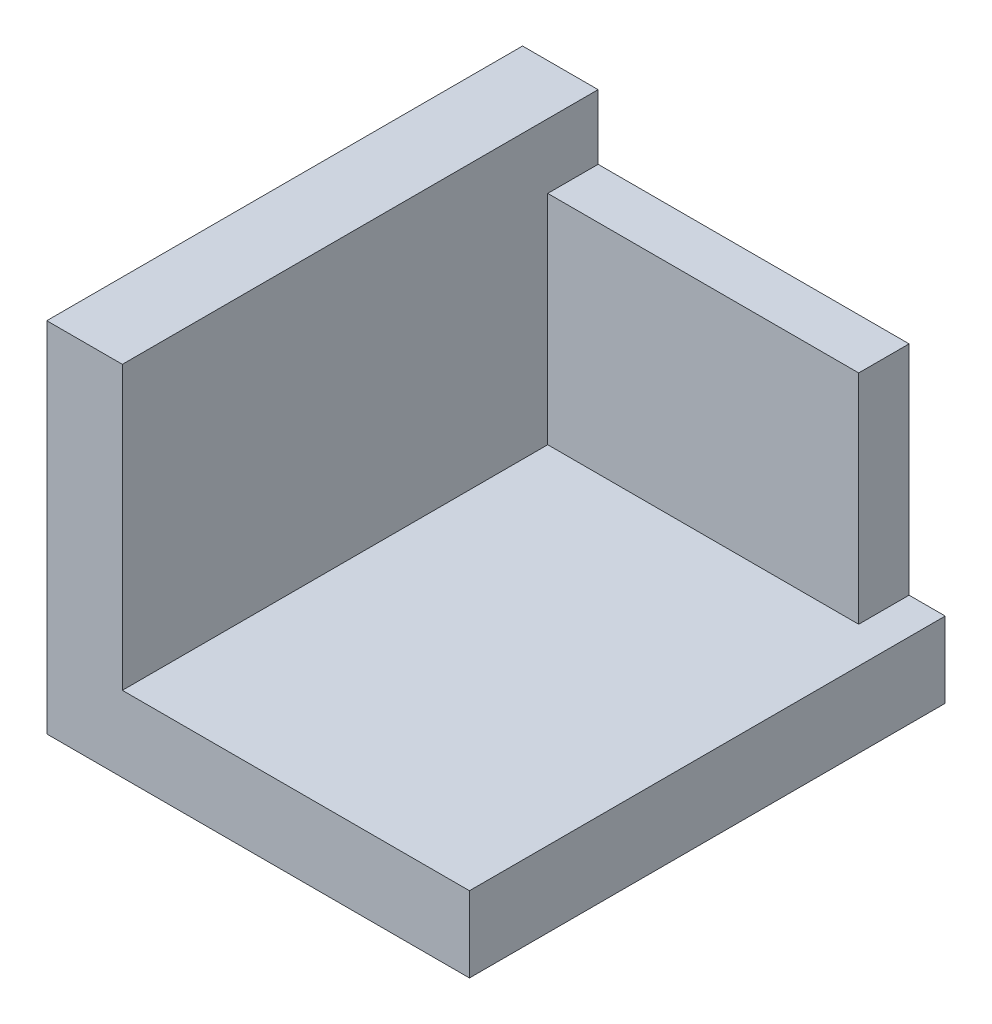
SolidWorks part; units mm, degrees
ref_plane "Front Plane" through (0, 0, 0) normal (0, 0, 1) x (1, 0, 0)
ref_plane "Top Plane" through (0, 0, 0) normal (0, 1, 0) x (1, 0, 0)
ref_plane "Right Plane" through (0, 0, 0) normal (1, 0, 0) x (0, 0, -1)
sketch "Sketch3" plane through (0, 0, 0) normal (0, 1, 0) x (1, 0, 0)
  line L1 (0, 0) -> (68.8876, 0)
  line L2 (0, 0) -> (0, 94.4235)
  line L3 (0, 94.4235) -> (68.8876, 94.4235)
  line L4 (68.8876, 0) -> (68.8876, 94.4235)
extrude "Boss-Extrude2" add sketch "Sketch3" along normal blind 15
sketch "Sketch4" plane through (0, 0, 0) normal (-1, 0, 0) x (0, 0, 1)
  line L0 (-94.4235, 15) -> (-94.4235, 0) construction
  line L1 (0, 0) -> (-94.4235, 0)
  line L2 (0, 0) -> (0, 71.033)
  line L3 (0, 71.033) -> (-94.4235, 71.033)
  line L4 (-94.4235, 0) -> (-94.4235, 71.033)
extrude "Boss-Extrude3" add sketch "Sketch4" along normal blind 15
sketch "Sketch5" plane through (0, 0, -94.4235) normal (0, 0, -1) x (-1, 0, 0)
  line L1 (0, 15) -> (-61.7153, 15)
  line L2 (0, 15) -> (0, 58.199)
  line L3 (0, 58.199) -> (-61.7153, 58.199)
  line L4 (-61.7153, 15) -> (-61.7153, 58.199)
extrude "Boss-Extrude4" add sketch "Sketch5" against normal blind 10
ref_plane "Plane1" through (0, 0, -40) normal (0, 0, 1) x (1, 0, 0)
